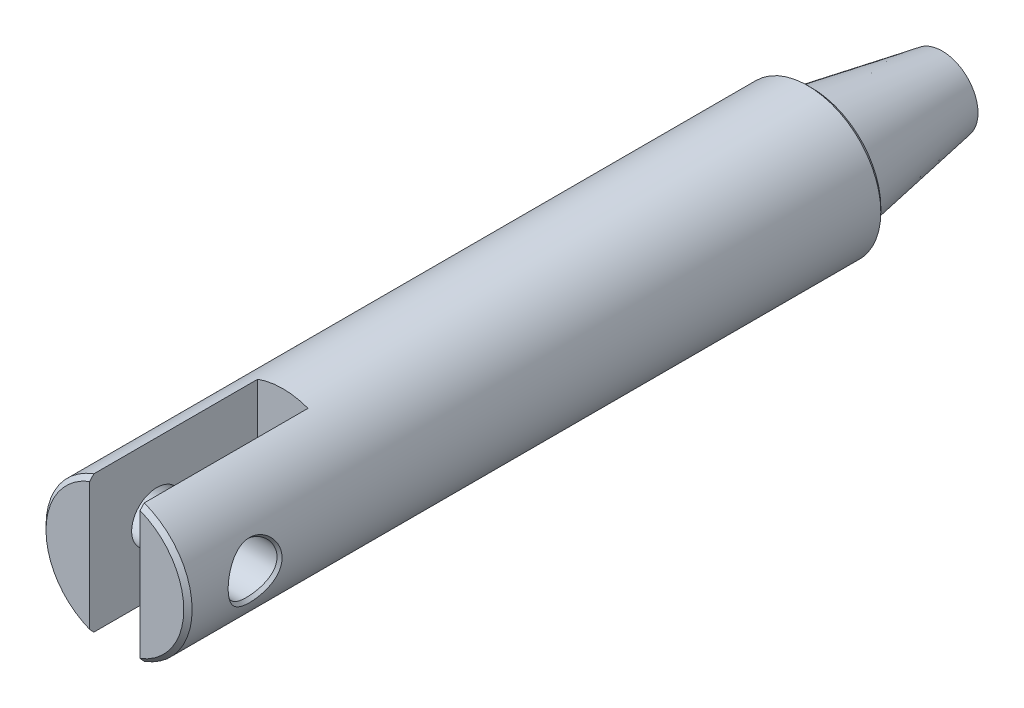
SolidWorks part; units mm, degrees
ref_plane "Front" through (0, 0, 0) normal (0, 0, 1) x (1, 0, 0)
ref_plane "Top" through (0, 0, 0) normal (0, 1, 0) x (1, 0, 0)
ref_plane "Right" through (0, 0, 0) normal (1, 0, 0) x (0, 0, -1)
sketch "Esquisse1" plane through (0, 0, 0) normal (0, 0, 1) x (1, 0, 0)
  circle A0 centre (0, 0) radius 4.35
  dimension "D1" = 8.7
extrude "Boss.-Extru.1" add sketch "Esquisse1" along normal blind 41.5
sketch "Esquisse2" plane through (0, 0, 0) normal (0, 0, -1) x (-1, 0, 0)
  circle A0 centre (0, 0) radius 3.5
  dimension "D1" = 7
extrude "Boss.-Extru.2" add sketch "Esquisse2" along normal blind 8 draft 10
chamfer "Chanfrein1" distance 0.25 angle 45 3 edges at (-2.0894, 0, -8) (4.35, 0, 0) (4.35, 0, 41.5)
sketch "Esquisse3" plane through (0, 0, 41.5) normal (0, 0, 1) x (1, 0, 0)
  line L1 (-1.5, 5) -> (1.5, 5)
  line L2 (-1.5, 5) -> (-1.5, -5)
  line L3 (-1.5, -5) -> (1.5, -5)
  line L4 (1.5, 5) -> (1.5, -5)
  line L5 (-1.5, 5) -> (1.5, -5) construction
  line L6 (-1.5, -5) -> (1.5, 5) construction
  point P0 (0, 0)
  dimension "D1" = 3
  dimension "D2" = 10
extrude "Enlèv. mat.-Extru.1" cut sketch "Esquisse3" against normal blind 10
sketch "Esquisse4" plane through (0, 0, 0) normal (1, 0, 0) x (0, 0, -1)
  line L0 (-41.5, 0) -> (0, 0) construction
  line L1 (-41.5, 3.8158) -> (-41.5, -3.8158) construction
  circle A0 centre (-37.5, 0) radius 1.5
  dimension "D1" = 3
  dimension "D2" = 4
extrude "Enlèv. mat.-Extru.2" cut sketch "Esquisse4" against normal up to next and the other way up to next
chamfer "Chanfrein2" distance 0.25 angle 45 2 edges at (-4.3429, 0.2489, 38.9792) (4.3429, -0.2489, 36.0208)
